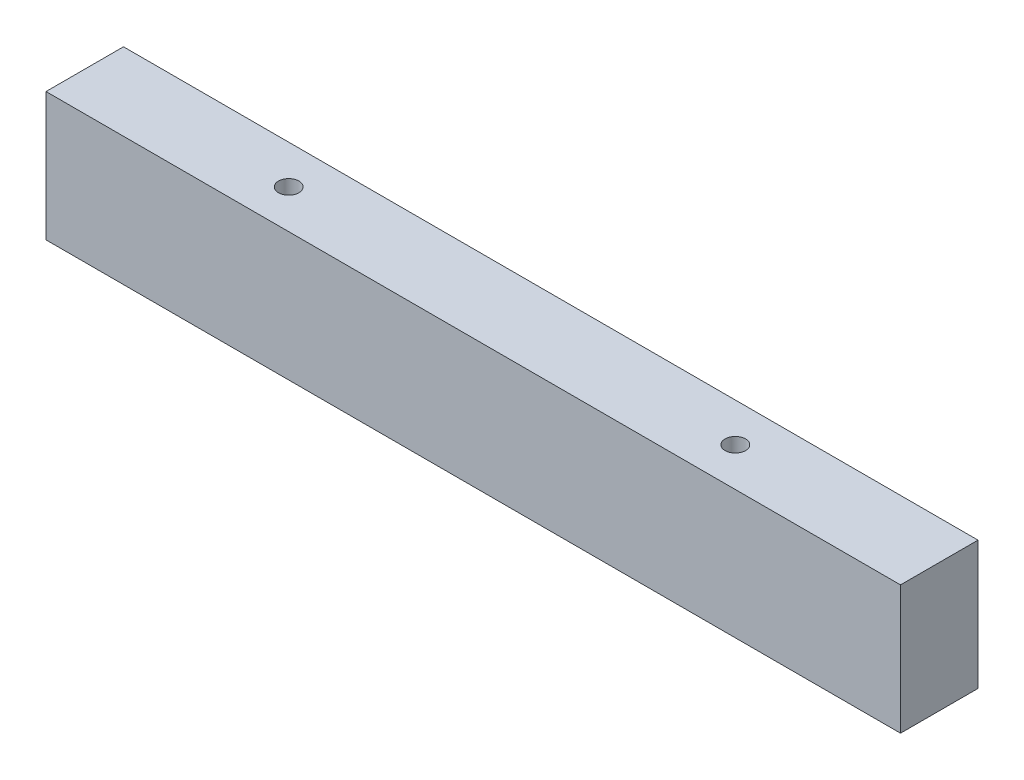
SolidWorks part; units mm, degrees
ref_plane "Front Plane" through (0, 0, 0) normal (0, 0, 1) x (1, 0, 0)
ref_plane "Top Plane" through (0, 0, 0) normal (0, 1, 0) x (1, 0, 0)
ref_plane "Right Plane" through (0, 0, 0) normal (1, 0, 0) x (0, 0, -1)
sketch "Sketch1" plane through (0, 0, 0) normal (0, 0, 1) x (1, 0, 0)
  line L1 (0, 0) -> (419, 0)
  line L2 (0, 0) -> (0, 63)
  line L3 (0, 63) -> (419, 63)
  line L4 (419, 0) -> (419, 63)
  dimension "D1" = 419
  dimension "D2" = 63
extrude "Boss-Extrude1" add sketch "Sketch1" along normal blind 38
sketch "Sketch2" plane through (0, 63, 0) normal (0, 1, 0) x (1, 0, 0)
  line L0 (0, -19) -> (419, -19) construction
  line L1 (0, -38) -> (0, 0) construction
  line L2 (419, -38) -> (419, 0) construction
  circle A2 centre (100, -19) radius 5
  circle A3 centre (319, -19) radius 5
  point P10 (0, 0)
  point P11 (0, 0)
  point P12 (0, 0)
  point P13 (0, 0)
  dimension "D1" = 100
  dimension "D2" = 100
extrude "Cut-Extrude2" cut sketch "Sketch2" against normal up to next
